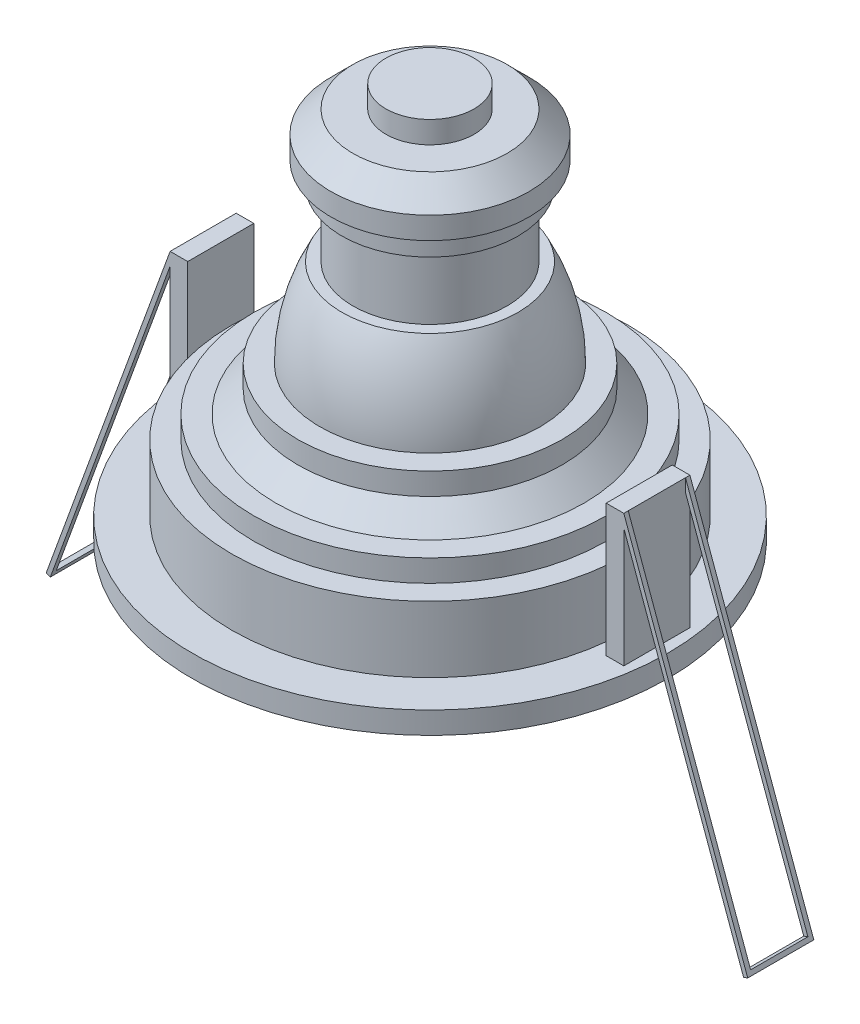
SolidWorks part; units mm, degrees
ref_plane "Alzado" through (0, 0, 0) normal (0, 0, 1) x (1, 0, 0)
ref_plane "Planta" through (0, 0, 0) normal (0, 1, 0) x (1, 0, 0)
ref_plane "Vista lateral" through (0, 0, 0) normal (1, 0, 0) x (0, 0, -1)
sketch "Croquis1" plane through (0, 0, 0) normal (0, 0, 1) x (1, 0, 0)
  line L0 (0, 20) -> (0, 90) construction
  line L1 (-39, 0) -> (-54, 0)
  line L2 (-54, 0) -> (-54, 5)
  line L4 (-45, 5) -> (-45, 20)
  line L5 (-45, 20) -> (-40, 20)
  line L6 (-54, 5) -> (-45, 5)
  line L7 (-45, 20) -> (-40, 20)
  line L8 (-40, 20) -> (-40, 25)
  line L9 (-40, 25) -> (-35, 25)
  line L10 (0, 25) -> (0, 30)
  line L11 (-30, 30) -> (-30, 35)
  line L12 (-30, 30) -> (-35, 25)
  line L13 (0, 25) -> (0, 20)
  line L14 (-30, 35) -> (-25, 35)
  line L17 (-20, 55) -> (-17.5, 55)
  line L18 (-17.5, 55) -> (-17.5, 70)
  line L19 (-17.5, 70) -> (-20, 70)
  line L20 (-20, 70) -> (-20, 75)
  line L21 (-20, 75) -> (-22.5, 75)
  line L22 (-22.5, 75) -> (-22.5, 80)
  line L24 (0, 80) -> (0, 85)
  line L25 (-10, 85) -> (-17.5, 85)
  line L26 (-17.5, 85) -> (-22.5, 80)
  line L27 (0, 90) -> (-10, 90)
  line L28 (-10, 90) -> (-10, 85)
  line L29 (0, 90) -> (0, 20)
  line L30 (0, 20) -> (-20, 20)
  line L31 (-54, 0) -> (-39, 0)
  arc A0 (-20, 55) -> (-25, 35) centre (17.5, 35) ccw
  arc A1 (-39, 0) -> (-20, 20) centre (-40, 19.975) ccw
revolve "Revolución1" add sketch "Croquis1" angle 360 about L0
sketch "Croquis2" plane through (0, 5, 0) normal (0, 1, 0) x (1, 0, 0)
  line L0 (0, 0) -> (-45, 0) construction
  line L1 (-45, 0) -> (-54, 0) construction
  line L3 (-51.5, 7.5) -> (-47.5, 7.5)
  line L4 (-47.5, 7.5) -> (-47.5, -7.5)
  line L5 (-47.5, -7.5) -> (-51.5, -7.5)
  line L6 (-51.5, -7.5) -> (-51.5, 7.5)
  circle A0 centre (0, 0) radius 45 construction
  circle A1 centre (0, 0) radius 54 construction
  point P12 (-49.5, 0)
  point P15 (-49.5, 7.5)
extrude "Saliente-Extruir1" add sketch "Croquis2" along normal blind 30
ref_plane "Plano1" through (-56.7244, 20.646, 0) normal (-0.9397, 0.342, 0) x (0, 0, 1)
sketch "Croquis3" plane through (-56.7244, 20.646, 0) normal (-0.9397, 0.342, 0) x (0, 0, 1)
  line L0 (-7.5, 15.2752) -> (-6.5, 15.2752)
  line L1 (7.5, 15.2752) -> (7.5, -66.9797)
  line L2 (7.5, -66.9797) -> (-7.5, -66.9797)
  line L3 (-7.5, 15.2752) -> (-7.5, -66.9797)
  line L4 (6.5, 15.2752) -> (6.5, -65.9797)
  line L5 (6.5, -65.9797) -> (-6.5, -65.9797)
  line L6 (-6.5, 15.2752) -> (-6.5, -65.9797)
  line L7 (6.5, 15.2752) -> (7.5, 15.2752)
  dimension "D1" = 1
extrude "Saliente-Extruir2" add sketch "Croquis3" against normal blind 1
mirror "Simetría1" about plane through (0, 0, 0) normal (1, 0, 0) of "Saliente-Extruir1", "Saliente-Extruir2"
